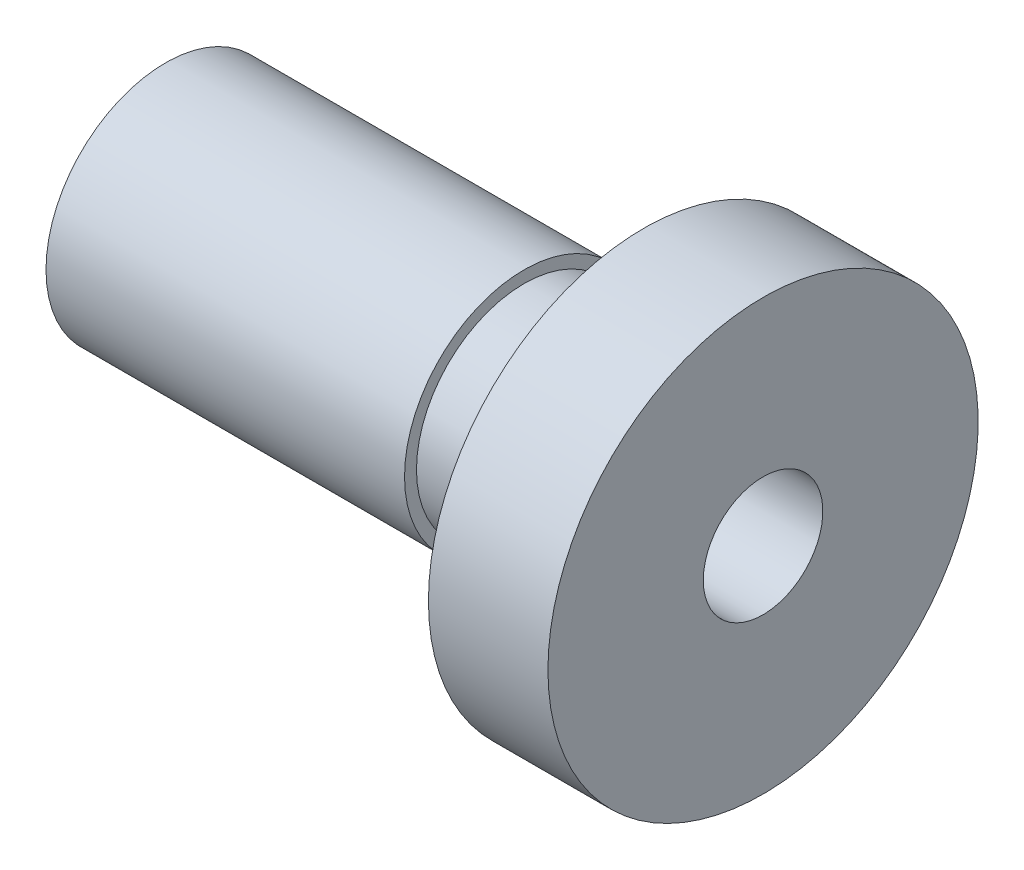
SolidWorks part; units mm, degrees
ref_plane "Plan de face" through (0, 0, 0) normal (0, 0, 1) x (1, 0, 0)
ref_plane "Plan de dessus" through (0, 0, 0) normal (0, 1, 0) x (1, 0, 0)
ref_plane "Plan de droite" through (0, 0, 0) normal (1, 0, 0) x (0, 0, -1)
sketch "Esquisse1" plane through (0, 0, 0) normal (0, 0, 1) x (1, 0, 0)
  line L0 (0, 0) -> (50, 0) construction
  line L1 (0, 5) -> (50, 5)
  line L2 (50, 5) -> (50, 18)
  line L3 (50, 18) -> (40, 18)
  line L4 (40, 18) -> (40, 9)
  line L5 (40, 9) -> (30, 9)
  line L6 (30, 9) -> (30, 10)
  line L7 (30, 10) -> (0, 10)
  line L8 (0, 10) -> (0, 5)
  dimension "D1" = 10
  dimension "D2" = 50
  dimension "D3" = 20
  dimension "D4" = 36
  dimension "D5" = 30
  dimension "D6" = 18
  dimension "D7" = 10
revolve "Révolution1" add sketch "Esquisse1" angle 360 about L0
